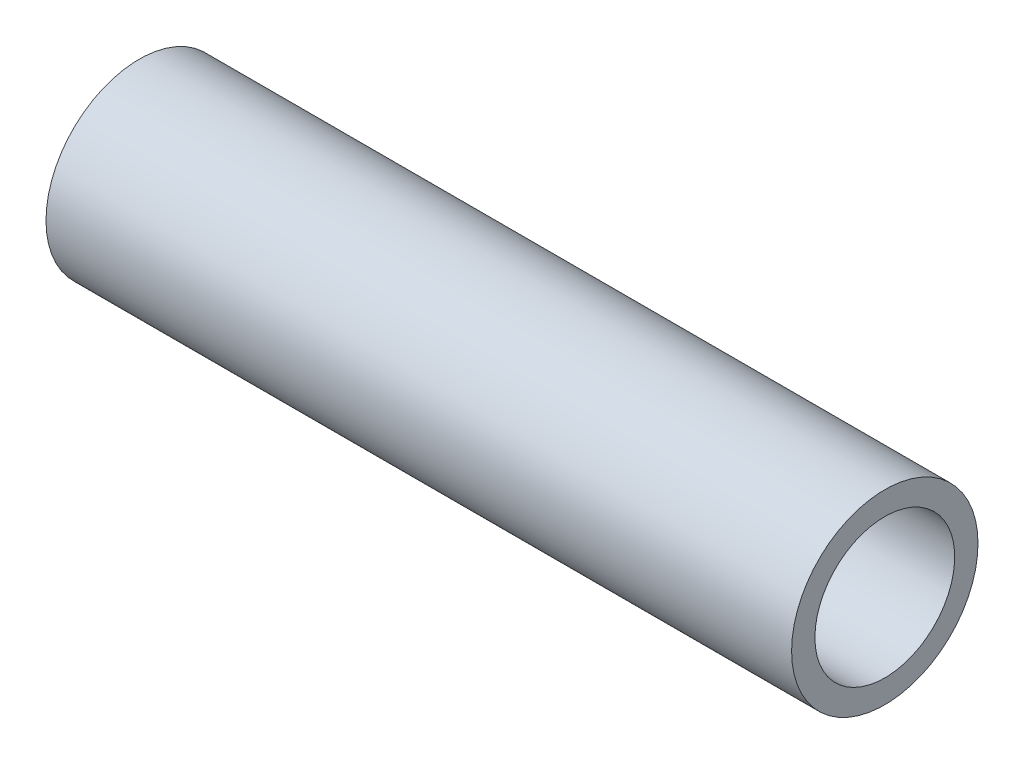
SolidWorks part; units mm, degrees
ref_plane "Front Plane" through (0, 0, 0) normal (0, 0, 1) x (1, 0, 0)
ref_plane "Top Plane" through (0, 0, 0) normal (0, 1, 0) x (1, 0, 0)
ref_plane "Right Plane" through (0, 0, 0) normal (1, 0, 0) x (0, 0, -1)
sketch "Sketch1" plane through (0, 0, 0) normal (1, 0, 0) x (0, 0, -1)
  circle A1 centre (0, 0) radius 3.175
  dimension "D1" = 6.35
extrude "Boss-Extrude1" add sketch "Sketch1" along normal blind 25.4
sketch "Sketch3" plane through (0, 0, 0) normal (-1, 0, 0) x (0, 0, 1)
  circle A0 centre (0, 0) radius 2.3813
  point P0 (0, 0)
  dimension "D1" = 4.7625
extrude "Cut-Extrude1" cut sketch "Sketch3" against normal through all
